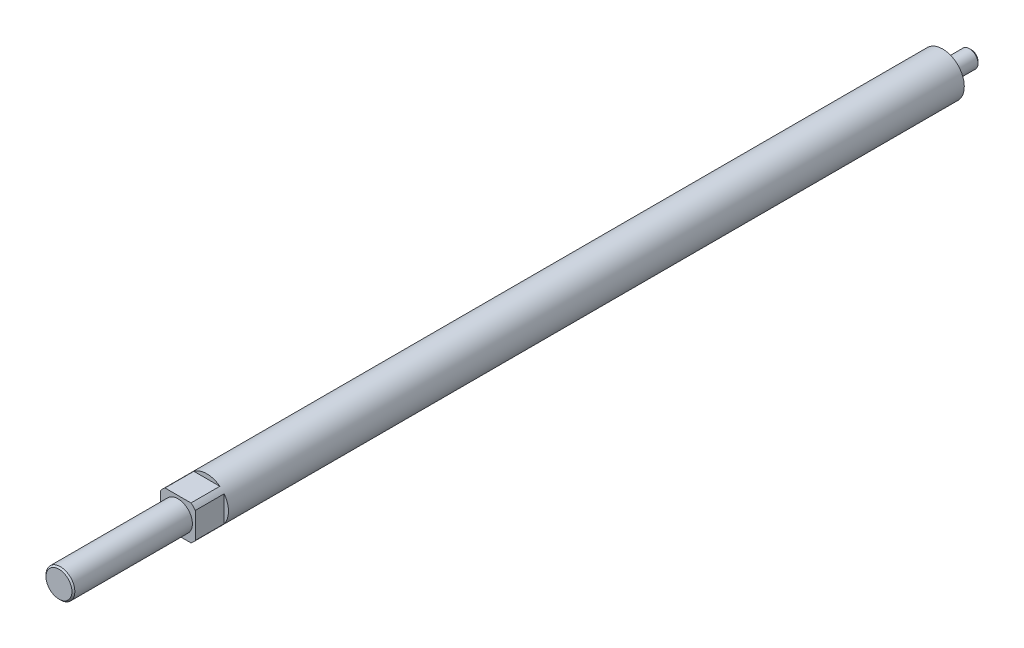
SolidWorks part; units mm, degrees
ref_plane "Frontal" through (0, 0, 0) normal (0, 0, 1) x (1, 0, 0)
ref_plane "Horizontal" through (0, 0, 0) normal (0, 1, 0) x (1, 0, 0)
ref_plane "Vertical" through (0, 0, 0) normal (1, 0, 0) x (0, 0, -1)
imported_body "Importée1"
sketch "Esquisse1" plane through (0, 0, 0) normal (1, 0, 0) x (0, 0, -1)
  line L0 (-20, -5) -> (-20, 5) construction
  line L1 (-20, 0) -> (135, 0)
  line L2 (-20, 0) -> (-20, 15)
  line L3 (-20, 15) -> (177, 15)
  line L4 (177, 5) -> (177, 15)
  line L5 (-20, 15) -> (-333, 15) construction
  line L6 (177, 5) -> (180, 5)
  line L7 (180, 5) -> (180, 6)
  line L8 (180, 6) -> (195.5, 6)
  line L9 (195.5, 6) -> (197, 4.5)
  line L10 (197, 4.5) -> (197, 0)
  line L11 (197, 0) -> (135, 0)
  line L12 (135, 0) -> (197.5901, 0) construction
  dimension "D1" = 197
  dimension "D2" = 3
  dimension "D3" = 10
  dimension "D4" = 12
  dimension "D5" = 17
  dimension "D6" = 1.5
  dimension "D7" = 45
revolve "Révolution1" add sketch "Esquisse1" angle 360 about L12
